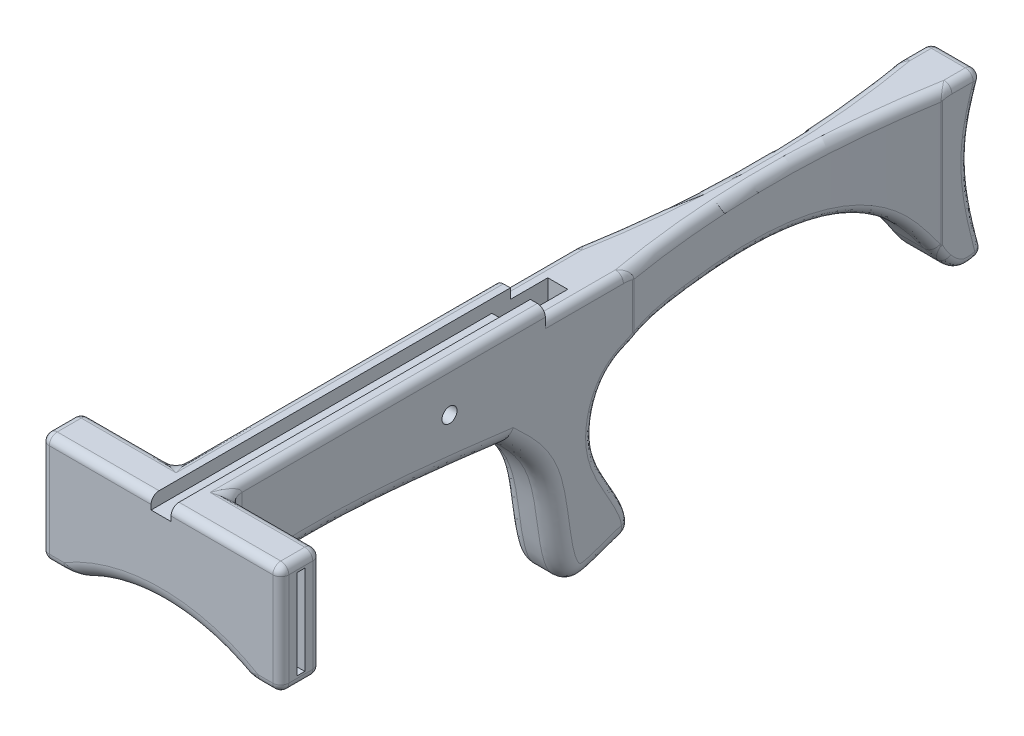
SolidWorks part; units mm, degrees
ref_plane "Front Plane" through (0, 0, 0) normal (0, 0, 1) x (1, 0, 0)
ref_plane "Top Plane" through (0, 0, 0) normal (0, 1, 0) x (1, 0, 0)
ref_plane "Right Plane" through (0, 0, 0) normal (1, 0, 0) x (0, 0, -1)
sketch "Sketch1" plane through (0, 0, 0) normal (0, 0, 1) x (1, 0, 0)
  line L1 (0, 0) -> (38.1, 0)
  line L2 (0, 0) -> (0, 17.4625)
  line L3 (0, 17.4625) -> (38.1, 17.4625)
  line L4 (38.1, 0) -> (38.1, 17.4625)
  dimension "D1" = 17.4625
  dimension "D2" = 38.1
extrude "Front Block" add sketch "Sketch1" along normal blind 6.35
ref_plane "Front Block Mid Plane" through (0, 0, 3.175) normal (0, 0, 1) x (1, 0, 0)
sketch "Sketch2" plane through (0, 0, 3.175) normal (0, 0, 1) x (1, 0, 0)
  line L0 (19.05, 17.4625) -> (19.05, 0) construction
  line L1 (38.1, 17.4625) -> (0, 17.4625) construction
  line L2 (0, 0) -> (38.1, 0) construction
  line L3 (0, 17.4625) -> (0, 0) construction
  line L4 (4.064, 15.8432) -> (0, 15.8432)
  line L5 (0, 15.8432) -> (0, 1.6193)
  line L6 (0, 1.6193) -> (4.064, 1.6192)
  line L7 (38.1, 1.6193) -> (34.036, 1.6193)
  line L8 (38.1, 15.8432) -> (38.1, 1.6193)
  line L9 (34.036, 15.8433) -> (38.1, 15.8432)
  arc A0 (4.064, 1.6192) -> (4.064, 15.8432) centre (4.064, 8.7312) ccw
  arc A1 (34.036, 1.6193) -> (34.036, 15.8433) centre (34.036, 8.7313) cw
  dimension "D1" = 14.224
  dimension "D2" = 8.7312
  dimension "D3" = 4.064
extrude "Bow Cut Outs" cut sketch "Sketch2" against normal mid plane 1.27
ref_plane "Plane2" through (19.05, 0, 0) normal (1, 0, 0) x (0, 0, -1)
sketch "Sketch4" plane through (19.05, 0, 0) normal (1, 0, 0) x (0, 0, -1)
  line L0 (120.65, 15.875) -> (50.8, 15.875)
  line L1 (0, 17.4625) -> (50.8, 17.4625)
  line L2 (0, 17.4625) -> (0, 2.8663)
  line L3 (0, 0) -> (0, 17.4625) construction
  line L5 (50.8, 15.875) -> (50.8, 17.4625)
  spline S0 degree 3 poles (0, 2.8663) (1.8961, 3.0592) (16.7116, 4.5666) (31.5838, 2.7339) (44.5526, 1.1357) knots 0 0 0 0 0.12798 1 1 1 1
  spline S1 degree 3 poles (44.5526, 1.1357) (46.967, -1.1575) (53.3726, -7.2414) (51.4406, -25.1991) (58.8747, -22.6008) (60.3554, -22.0833) knots 0 0 0 0 0.326349 0.865826 1 1 1 1
  spline S2 degree 3 poles (60.3554, -22.0833) (61.6076, -21.6313) (66.8086, -19.754) (59.5548, -10.5023) (57.8931, -3.1954) (61.0495, 6.2881) (68.5549, 6.5071) (74.0738, 6.6681) knots 0 0 0 0 0.084765 0.352061 0.536866 0.659445 1 1 1 1
  spline S3 degree 3 poles (74.0738, 6.6681) (87.2547, 7.0078) (103.0081, 7.4137) (111.3192, -4.1832) (112.6765, -6.0771) knots 0 0 0 0 0.836697 1 1 1 1
  spline S4 degree 3 poles (112.6765, -6.0771) (114.0996, -8.0895) (116.243, -11.1203) (119.5416, -10.1281) (120.65, -9.7947) knots 0 0 0 0 0.663971 1 1 1 1
  spline S5 degree 3 poles (120.65, 15.875) (119.7124, 13.1501) (116.8375, 4.7951) (119.1152, -3.9212) (120.65, -9.7947) knots 0 0 0 0 0.326144 1 1 1 1
  dimension "D1" = 50.8
  dimension "D3" = 1.5875
extrude "Main Body" add sketch "Sketch4" along normal mid plane 7.9375
sketch "Sketch6" plane through (0, 0, 0) normal (0, 0, 1) x (1, 0, 0)
  line L0 (38.1, 17.4625) -> (0, 17.4625) construction
  line L1 (17.4625, 17.4625) -> (20.6375, 17.4625)
  line L2 (17.4625, 17.4625) -> (17.4625, 15.4305)
  line L3 (17.4625, 15.4305) -> (20.6375, 15.4305)
  line L4 (20.6375, 17.4625) -> (20.6375, 15.4305)
  line L5 (19.05, -22.3015) -> (19.05, 22.3015) construction
  dimension "D1" = 3.175
  dimension "D2" = 2.032
  dimension "D3" = 1.5875
extrude "Cut-Extrude2" cut sketch "Sketch6" against normal mid plane 101.6
fillet "Fillet1" radius 2.54 2 edges
fillet "Fillet4" radius 2.54 2 edges
fillet "Fillet8" radius 1.27 5 edges at (17.4589, -21.9299, -60.7786) (19.05, -22.0833, -60.3554) (20.5992, -21.9922, -60.6075)
fillet "Fillet9" radius 1.27 2 edges
fillet "Fillet10" radius 1.27 2 edges
fillet "Fillet11" radius 1.27 5 edges at (15.3584, -9.9315, -120.1916) (19.05, -9.7947, -120.65) (22.5417, -9.8747, -120.3836)
fillet "Fillet12" radius 1.27 5 edges at (15.0813, 15.875, -85.0535) (15.5902, 15.875, -120.3822) (19.05, 15.875, -120.65) (22.711, 15.875, -120.1834) (23.0188, 15.875, -85.0535)
fillet "Fillet13" radius 1.27 8 edges at (19.05, 0, 0) (38.1, 0, 3.175) (0, 0, 3.175) (19.05, 0, 6.35) (0, 8.7312, 6.35) (0, 8.7312, 0) (38.1, 8.7312, 0) (38.1, 8.7312, 6.35)
fillet "Fillet14" radius 1.27 12 edges at (37.728, 17.4625, 0.372) (38.1, 17.4625, 3.175) (37.728, 17.4625, 5.978) (0.372, 17.4625, 0.372) (0, 17.4625, 3.175) (0.372, 17.4625, 5.978) (28.7337, 17.4625, 6.35) (9.3663, 17.4625, 6.35)
sketch "Sketch13" plane through (0, 0, 0) normal (1, 0, 0) x (0, 0, -1)
  line L0 (-6.35, 1.27) -> (-6.35, 16.1925) construction
  line L1 (-1.27, 17.4625) -> (50.8, 17.4625) construction
  circle A0 centre (35.56, 10.3505) radius 1.1906
  dimension "D2" = 2.3813
  dimension "D1" = 41.91
  dimension "D3" = 7.112
extrude "Cut-Extrude5" cut sketch "Sketch13" along normal through all
ref_plane "Plane4" through (0, 1.143, 0) normal (0, 1, 0) x (-1, 0, 0)
sketch "Sketch14" plane through (0, 1.143, 0) normal (0, 1, 0) x (-1, 0, 0)
  line L0 (-17.4625, -50.8) -> (-17.4625, 5.08) construction
  line L1 (-17.4625, -47.8631) -> (-20.6375, -47.8631)
  line L2 (-17.4625, -47.8631) -> (-17.4625, -56.7531)
  line L3 (-17.4625, -56.7531) -> (-20.6375, -56.7531)
  line L4 (-20.6375, -47.8631) -> (-20.6375, -56.7531)
  dimension "D1" = 3.175
  dimension "D2" = 8.89
extrude "Cut-Extrude8" cut sketch "Sketch14" along normal through all
sketch "Sketch17" plane through (0, 0, 0) normal (0, 0, 1) x (1, 0, 0)
  line L0 (1.27, 0) -> (36.83, 0) construction
  line L1 (1.27, 0) -> (36.83, 0) construction
  line L2 (0, 15.8432) -> (0, 1.6193) construction
  line L3 (38.1, 1.6193) -> (38.1, 15.8432) construction
  line L4 (6.604, 0) -> (31.496, 0)
  arc A0 (6.604, 0) -> (31.496, 0) centre (19.05, -25.0621) cw
  dimension "D1" = 6.604
  dimension "D2" = 6.604
extrude "Cut-Extrude11" cut sketch "Sketch17" along normal blind 12.7
fillet "Fillet15" radius 2.54 9 edges at (13.4496, 2.3541, 0) (6.821, 0.1066, 0.7607) (31.0851, 0.1999, 0.5861) (6.604, 0, 3.175) (31.496, 0, 3.175) (31.279, 0.1066, 5.5893) (7.0149, 0.1999, 5.7639) (19.05, 2.9202, 6.35) (24.6504, 2.3541, 0)
fillet "Fillet16" radius 2.54 4 edges at (22.6468, 17.0905, 0.372) (22.0756, 3.34, 0.9239)
fillet "Fillet17" radius 2.54 4 edges at (15.4532, 17.0905, 0.372) (16.1575, 3.2211, 1.0989)
sketch "Sketch18" plane through (0, 1.143, 0) normal (0, 1, 0) x (-1, 0, 0)
  line L0 (-15.0813, -50.8) -> (-15.0813, -118.8748) construction
  line L1 (-19.05, -120.2475) -> (-19.05, -63.203) construction
  line L2 (-19.05, 22.9967) -> (-19.05, -22.9967) construction
  line L3 (-15.0813, -113.8856) -> (-15.0813, -64.8086)
  line L4 (-23.0188, -113.8856) -> (-23.0188, -64.8086)
  line L5 (-23.0188, -64.8086) -> (-23.0835, -64.6771)
  arc A0 (-15.0813, -113.8856) -> (-15.0813, -64.8086) centre (129.6415, -89.3471) cw
  arc A1 (-23.0188, -113.8856) -> (-23.0188, -64.8086) centre (-167.7415, -89.3471) ccw
extrude "Cut-Extrude12" cut sketch "Sketch18" along normal mid plane 38.1 contours L3 A0 | L4 A1
fillet "Fillet18" radius 1.524 10 edges at (15.0979, -5.8026, -113.7874) (15.0812, 4.509, -113.8856) (15.1038, 14.8434, -64.9421) (15.1148, 14.3149, -113.6867) (17.1468, 15.875, -89.3471) (15.0812, 10.7804, -64.8086) (15.2312, 6.5718, -65.7101) (17.1325, 6.3606, -91.396) (15.2219, -5.4029, -113.041)
fillet "Fillet19" radius 1.524 10 edges at (20.9675, 6.3606, -91.396) (22.8781, -5.4029, -113.041) (23.0021, -5.8026, -113.7874) (23.0188, 4.509, -113.8856) (22.9962, 14.3666, -113.7521) (23.0178, 14.5552, -113.8798) (20.9532, 15.875, -89.3471) (23.0188, 10.7804, -64.8086) (22.8688, 6.5718, -65.7101)
sketch "Sketch19" plane through (0, 1.143, 0) normal (0, 1, 0) x (-1, 0, 0)
  line L0 (-20.6375, -47.8631) -> (-20.6375, 6.35) construction
  line L1 (-17.4625, -56.7531) -> (-20.6375, -56.7531)
  line L2 (-17.4625, -56.7531) -> (-17.4625, -31.3531)
  line L3 (-17.4625, -31.3531) -> (-20.6375, -31.3531)
  line L4 (-20.6375, -56.7531) -> (-20.6375, -31.3531)
  dimension "D1" = 25.4
extrude "Cut-Extrude13" cut sketch "Sketch19" along normal blind 12.7
sketch "Sketch20" plane through (0, 0, 0) normal (1, 0, 0) x (0, 0, -1)
  circle A0 centre (35.56, 10.3505) radius 2.413
  dimension "D1" = 4.826
extrude "Cut-Extrude14" cut sketch "Sketch20" along normal blind 16.256
